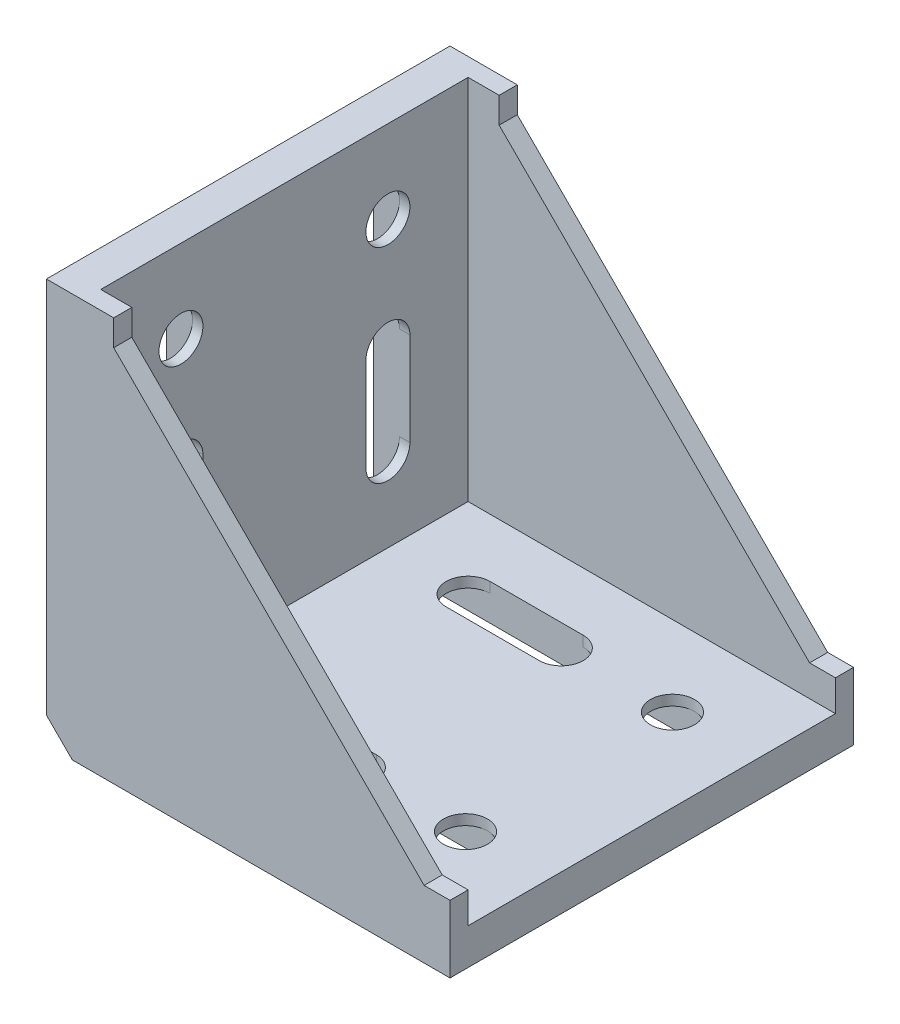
SolidWorks part; units mm, degrees
ref_plane "前视基准面" through (0, 0, 0) normal (0, 0, 1) x (1, 0, 0)
ref_plane "上视基准面" through (0, 0, 0) normal (0, 1, 0) x (1, 0, 0)
ref_plane "右视基准面" through (0, 0, 0) normal (1, 0, 0) x (0, 0, -1)
sketch "草图1" plane through (0, 0, 0) normal (0, 0, 1) x (1, 0, 0)
  line L0 (0, 78) -> (7, 78)
  line L1 (7, 78) -> (7, 7)
  line L2 (7, 7) -> (78, 7)
  line L3 (78, 7) -> (78, 0)
  line L4 (78, 0) -> (0, 0)
  line L5 (0, 0) -> (0, 78)
  dimension "D1" = 7
  dimension "D2" = 78
  dimension "D3" = 7
  dimension "D4" = 78
extrude "凸台-拉伸1" add sketch "草图1" along normal mid plane 78
sketch "草图2" plane through (0, 0, 39) normal (0, 0, 1) x (1, 0, 0)
  line L0 (7, 78) -> (13, 78)
  line L1 (13, 78) -> (13, 73)
  line L2 (13, 73) -> (73, 13)
  line L3 (73, 13) -> (78, 13)
  line L4 (78, 13) -> (78, 7)
  line L5 (78, 7) -> (7, 7)
  line L6 (7, 7) -> (7, 78) construction
  line L7 (78, 7) -> (7, 7) construction
  line L8 (7, 7) -> (7, 78)
  dimension "D1" = 6
  dimension "D2" = 6
  dimension "D3" = 5
  dimension "D4" = 5
extrude "凸台-拉伸2" add sketch "草图2" against normal blind 3.5
mirror "镜向1" about plane through (0, 0, 0) normal (0, 0, 1) of "凸台-拉伸2"
sketch "草图3" plane through (0, 0, 0) normal (0, -1, 0) x (1, 0, 0)
  line L0 (40.5, 20) -> (22.5, 20) construction
  line L1 (40.5, 15.75) -> (22.5, 15.75)
  line L2 (40.5, 24.25) -> (22.5, 24.25)
  line L3 (0, 39) -> (78, 39) construction
  line L4 (78, 39) -> (78, -39) construction
  line L5 (0, 39) -> (0, -39) construction
  line L6 (78, 0) -> (0, 0) construction
  line L7 (40.5, -20) -> (22.5, -20) construction
  line L8 (40.5, -15.75) -> (22.5, -15.75)
  line L9 (40.5, -24.25) -> (22.5, -24.25)
  circle A0 centre (62, 20) radius 4.25
  arc A1 (40.5, 15.75) -> (40.5, 24.25) centre (40.5, 20) ccw
  arc A2 (22.5, 24.25) -> (22.5, 15.75) centre (22.5, 20) ccw
  circle A3 centre (62, -20) radius 4.25
  arc A4 (40.5, -15.75) -> (40.5, -24.25) centre (40.5, -20) cw
  arc A5 (22.5, -24.25) -> (22.5, -15.75) centre (22.5, -20) cw
  point P4 (31.5, 20)
  point P22 (31.5, -20)
  dimension "D6" = 8.5
  dimension "D1" = 19
  dimension "D2" = 18
  dimension "D3" = 19
  dimension "D4" = 16
  dimension "D5" = 22.5
  dimension "D7" = 8.5
extrude "切除-拉伸1" cut sketch "草图3" against normal through all
sketch "草图4" plane through (0, 0, 0) normal (0, -1, 0) x (1, 0, 0)
  line L0 (73, 35.5) -> (73, 27.5)
  line L1 (73, 27.5) -> (6.5, 27.5)
  line L2 (6.5, 27.5) -> (6.5, 35.5)
  line L3 (6.5, 35.5) -> (73, 35.5)
  line L4 (62, 24.25) -> (70, 24.25)
  line L5 (70, 24.25) -> (70, 15.75)
  line L6 (70, 15.75) -> (10, 15.75)
  line L7 (10, 15.75) -> (10, 24.25)
  line L8 (10, 24.25) -> (62, 24.25)
  line L9 (78, 0) -> (0, 0) construction
  line L10 (78, 39) -> (78, -39) construction
  line L11 (10, -24.25) -> (62, -24.25)
  line L12 (10, -15.75) -> (10, -24.25)
  line L13 (70, -15.75) -> (10, -15.75)
  line L14 (70, -24.25) -> (70, -15.75)
  line L15 (62, -24.25) -> (70, -24.25)
  line L16 (6.5, -35.5) -> (73, -35.5)
  line L17 (6.5, -27.5) -> (6.5, -35.5)
  line L18 (73, -27.5) -> (6.5, -27.5)
  line L19 (73, -35.5) -> (73, -27.5)
  line L20 (0, 39) -> (78, 39) construction
  line L21 (0, 39) -> (0, -39) construction
  circle A0 centre (62, 20) radius 4.25 construction
  dimension "D1" = 8
  dimension "D2" = 3.5
  dimension "D3" = 5
  dimension "D4" = 6.5
  dimension "D5" = 8
  dimension "D6" = 10
extrude "切除-拉伸2" cut sketch "草图4" against normal blind 5
sketch "草图5" plane through (0, 0, 0) normal (0, -1, 0) x (1, 0, 0)
  line L0 (70, 20) -> (70, 16.1)
  line L1 (70, 15.75) -> (70, 24.25) construction
  line L2 (70, 16.1) -> (72, 16.1)
  line L3 (72, 16.1) -> (72, 23.9)
  line L4 (72, 23.9) -> (70, 23.9)
  line L5 (70, 23.9) -> (70, 20)
  line L6 (10, 23.9) -> (8, 23.9)
  line L7 (10, 24.25) -> (10, 15.75) construction
  line L8 (8, 23.9) -> (8, 16.05)
  line L9 (8, 16.05) -> (10, 16.05)
  line L10 (10, 16.05) -> (10, 20)
  line L11 (10, 20) -> (10, 23.9)
  line L12 (0, 39) -> (78, 39) construction
  line L13 (0, 0) -> (78, 0) construction
  line L14 (78, 39) -> (78, -39) construction
  line L15 (10, -20) -> (10, -23.9)
  line L16 (10, -16.05) -> (10, -20)
  line L17 (8, -16.05) -> (10, -16.05)
  line L18 (8, -23.9) -> (8, -16.05)
  line L19 (10, -23.9) -> (8, -23.9)
  line L20 (70, -23.9) -> (70, -20)
  line L21 (72, -23.9) -> (70, -23.9)
  line L22 (72, -16.1) -> (72, -23.9)
  line L23 (70, -16.1) -> (72, -16.1)
  line L24 (70, -20) -> (70, -16.1)
  dimension "D1" = 7.85
  dimension "D2" = 15.1
  dimension "D3" = 2
  dimension "D4" = 7.8
  dimension "D5" = 2
  dimension "D6" = 15.1
extrude "凸台-拉伸3" add sketch "草图5" along normal blind 2
sketch "草图6" plane through (0, 0, 0) normal (0, -1, 0) x (1, 0, 0)
  line L0 (72.3108, 12) -> (72.3108, -12)
  line L1 (72.3108, -12) -> (7.4512, -12)
  line L2 (7.4512, -12) -> (7.4512, 12)
  line L3 (7.4512, 12) -> (72.3108, 12)
  line L4 (0, -39) -> (78, -39) construction
  dimension "D1" = 24
  dimension "D2" = 27
extrude "切除-拉伸3" cut sketch "草图6" against normal blind 5
ref_plane "基准面2" through (0, 0, 0) normal (-0.7071, 0.7071, 0) x (-0.7071, -0.7071, 0)
mirror "镜向2" about plane through (0, 0, 0) normal (-0.7071, 0.7071, 0) of "切除-拉伸1"
mirror "镜向3" about plane through (0, 0, 0) normal (-0.7071, 0.7071, 0) of "切除-拉伸2"
mirror "镜向4" about plane through (0, 0, 0) normal (-0.7071, 0.7071, 0) of "切除-拉伸3"
mirror "镜向5" about plane through (0, 0, 0) normal (-0.7071, 0.7071, 0) of "凸台-拉伸3"
chamfer "倒角1" distance 5 angle 45 1 edges at (0, 0, 0)
